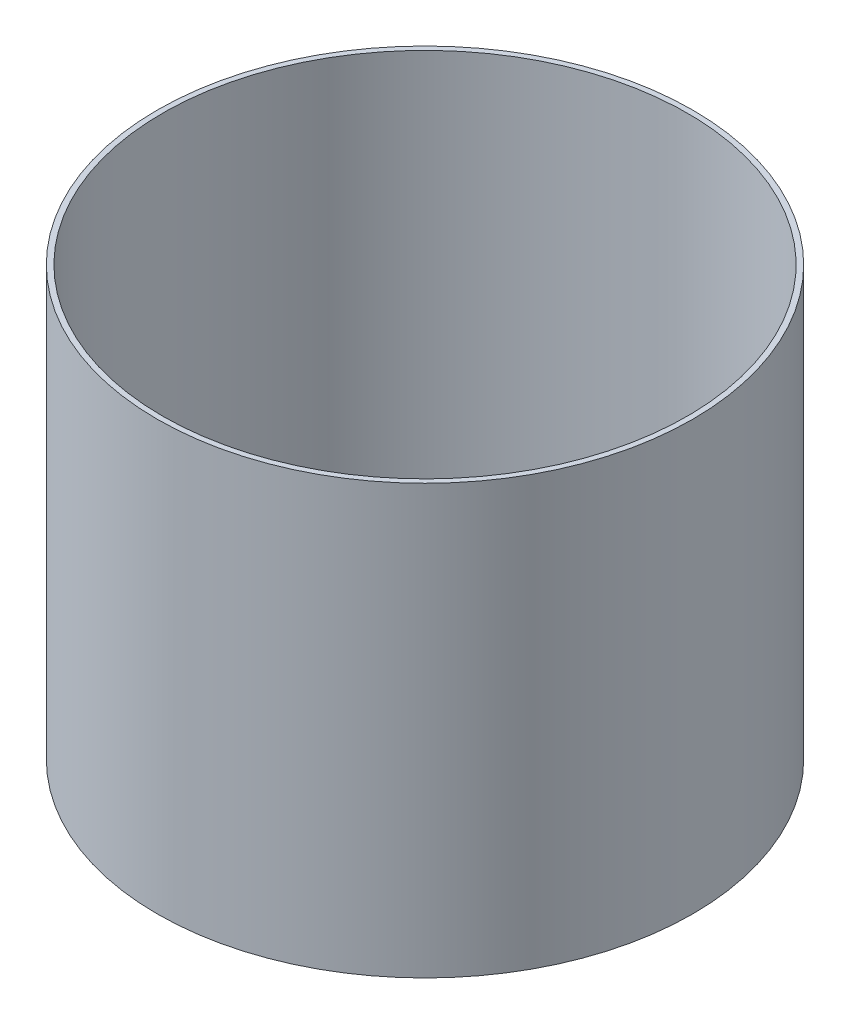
SolidWorks part; units mm, degrees
ref_plane "Front Plane" through (0, 0, 0) normal (0, 0, 1) x (1, 0, 0)
ref_plane "Top Plane" through (0, 0, 0) normal (0, 1, 0) x (1, 0, 0)
ref_plane "Right Plane" through (0, 0, 0) normal (1, 0, 0) x (0, 0, -1)
sketch "Sketch1" plane through (0, 0, 0) normal (0, 1, 0) x (1, 0, 0)
  circle A0 centre (0, 0) radius 127
  dimension "D1" = 254
extrude "Initial Glass" add sketch "Sketch1" against normal blind 203.2 thin
